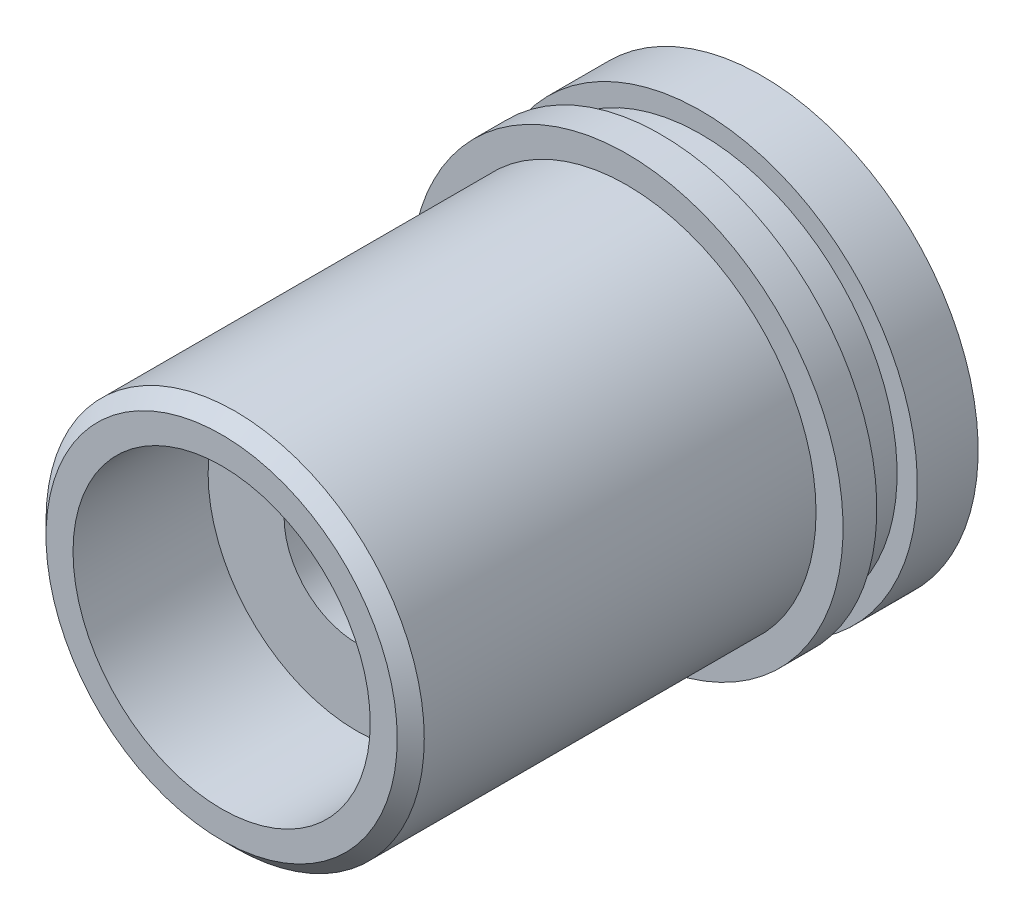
SolidWorks part; units mm, degrees
ref_plane "XY" through (0, 0, 0) normal (0, 0, 1) x (1, 0, 0)
ref_plane "XZ" through (0, 0, 0) normal (0, 1, 0) x (1, 0, 0)
ref_plane "YZ" through (0, 0, 0) normal (1, 0, 0) x (0, 0, -1)
sketch "Esquisse1" plane through (0, 0, 0) normal (0, 1, 0) x (1, 0, 0)
  line L0 (0, 11.0873) -> (0, -45.8275) construction
  line L1 (-8, 10) -> (-16, 10)
  line L2 (-16, 10) -> (-16, 5.5)
  line L3 (-16, 5.5) -> (-14.5, 5.5)
  line L4 (-14.5, 5.5) -> (-14.5, 2.5)
  line L5 (-14.5, 2.5) -> (-16, 2.5)
  line L6 (-16, 2.5) -> (-16, 0)
  line L7 (-16, 0) -> (-14, 0)
  line L8 (-14, 0) -> (-14, -30)
  line L9 (-14, -30) -> (-11, -30)
  line L10 (-11, -30) -> (-11, -20)
  line L11 (-11, -20) -> (-5.3753, -20)
  line L12 (-5.3753, -20) -> (-8, 10)
  dimension "D1" = 32
  dimension "D2" = 10
  dimension "D3" = 30
  dimension "D4" = 28
  dimension "D5" = 5
  dimension "D6" = 16
  dimension "D7" = 2.5
  dimension "D8" = 3
  dimension "D9" = 29
  dimension "D10" = 22
  dimension "D11" = 10
revolve "Bague d16" add sketch "Esquisse1" angle 360 about L0
chamfer "Chanf 1" distance 1 angle 45
